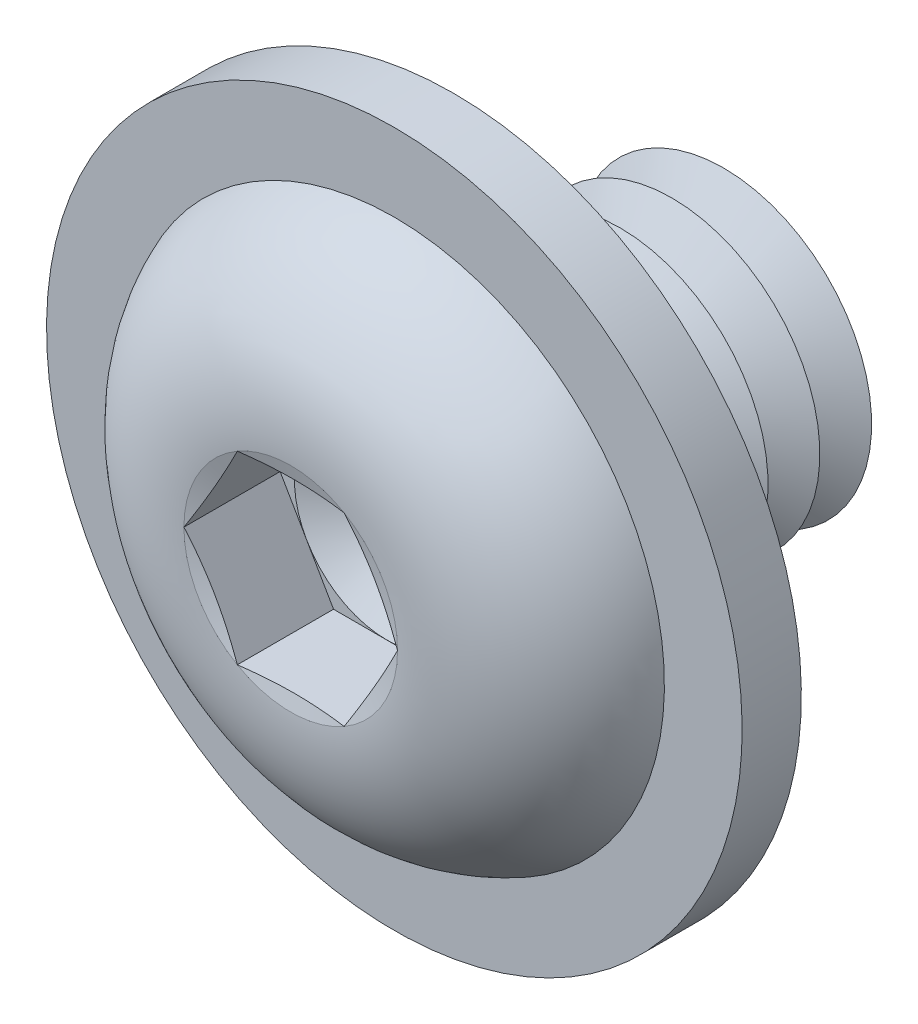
SolidWorks part; units mm, degrees
ref_plane "Front Plane" through (0, 0, 0) normal (0, 0, 1) x (1, 0, 0)
ref_plane "Top Plane" through (0, 0, 0) normal (0, 1, 0) x (1, 0, 0)
ref_plane "Right Plane" through (0, 0, 0) normal (1, 0, 0) x (0, 0, -1)
sketch "Sketch1" plane through (0, 0, 0) normal (1, 0, 0) x (0, 0, -1)
  line L0 (0, 2) -> (0, 3.8)
  line L3 (0, 2) -> (4, 2)
  line L4 (4, 2) -> (4, 0)
  line L5 (4, 0) -> (-2.2, 0) construction
  line L6 (-2.2, 0) -> (4, 0)
  line L7 (-2.2, 1.4434) -> (-2.2, 0.7217) construction
  line L8 (-2.2, 0.7217) -> (-2.2, 0)
  line L9 (-2.2, 1.4434) -> (-2.0066, 0.7217)
  line L10 (-2.0066, 0.7217) -> (-2.2, 0.7217)
  line L11 (4, 0) -> (22.7481, 0) construction
  line L12 (0, 3.8) -> (-2.2, 3.8) construction
  arc A1 (0, 3.8) -> (-2.2, 1.4434) centre (0, 1.5948) ccw
  point P8 (4, 1)
  dimension "D1" = 7.6
  dimension "D2" = 4
  dimension "D3" = 2.2
  dimension "D4" = 2.8868
  dimension "D5" = 4
  dimension "D6" = 15
revolve "Revolve1" add sketch "Sketch1" angle 360 about L5
fillet "Fillet1" radius 0.35 1 edges at (0, 2, 0)
sketch "Sketch2" plane through (0, 0, 0) normal (1, 0, 0) x (0, 0, -1)
  line L0 (3.65, 2) -> (4.35, 2)
  line L1 (4, 2) -> (0.35, 2) construction
  line L2 (4.35, 2) -> (4, 1.3938)
  line L3 (4, -2) -> (4, 2) construction
  line L4 (4, 1.3938) -> (3.65, 2)
  dimension "D1" = 0.7
revolve "Cut-Revolve1" cut sketch "Sketch2" angle 360 about axis through (0, 0, -4) along (0, 0, -1)
pattern_linear "LPattern1" count 5 spacing 0.7 along (0, 0, 1) of "Cut-Revolve1"
sketch "Sketch3" plane through (0, 0, 2.2) normal (0, 0, 1) x (1, 0, 0)
  line L7 (0.7217, 1.25) -> (-0.7217, 1.25)
  line L8 (-0.7217, 1.25) -> (-1.4434, 0)
  line L9 (-1.4434, 0) -> (-0.7217, -1.25)
  line L10 (-0.7217, -1.25) -> (0.7217, -1.25)
  line L11 (0.7217, -1.25) -> (1.4434, 0)
  line L12 (1.4434, 0) -> (0.7217, 1.25)
  circle A0 centre (0, 0) radius 1.25 construction
  circle A3 centre (0, 0) radius 1.4434 construction
extrude "Cut-Extrude1" cut sketch "Sketch3" against normal blind 1.3
sketch "Sketch4" plane through (0, 0, 0.9) normal (0, 0, 1) x (1, 0, 0)
  line L1 (0.7217, 1.25) -> (-0.7217, 1.25) construction
  circle A0 centre (0, 0) radius 1.25
extrude "Cut-Extrude2" cut sketch "Sketch4" against normal through all draft 60
sketch "Sketch5" plane through (0, 0, 0) normal (0, 0, -1) x (-1, 0, 0)
  circle A0 centre (0, 0) radius 4.7
  circle A1 centre (0, 0) radius 2.35
  circle A2 centre (0, 0) radius 2.35 construction
  dimension "D1" = 9.4
extrude "Boss-Extrude1" add sketch "Sketch5" against normal blind 0.8
